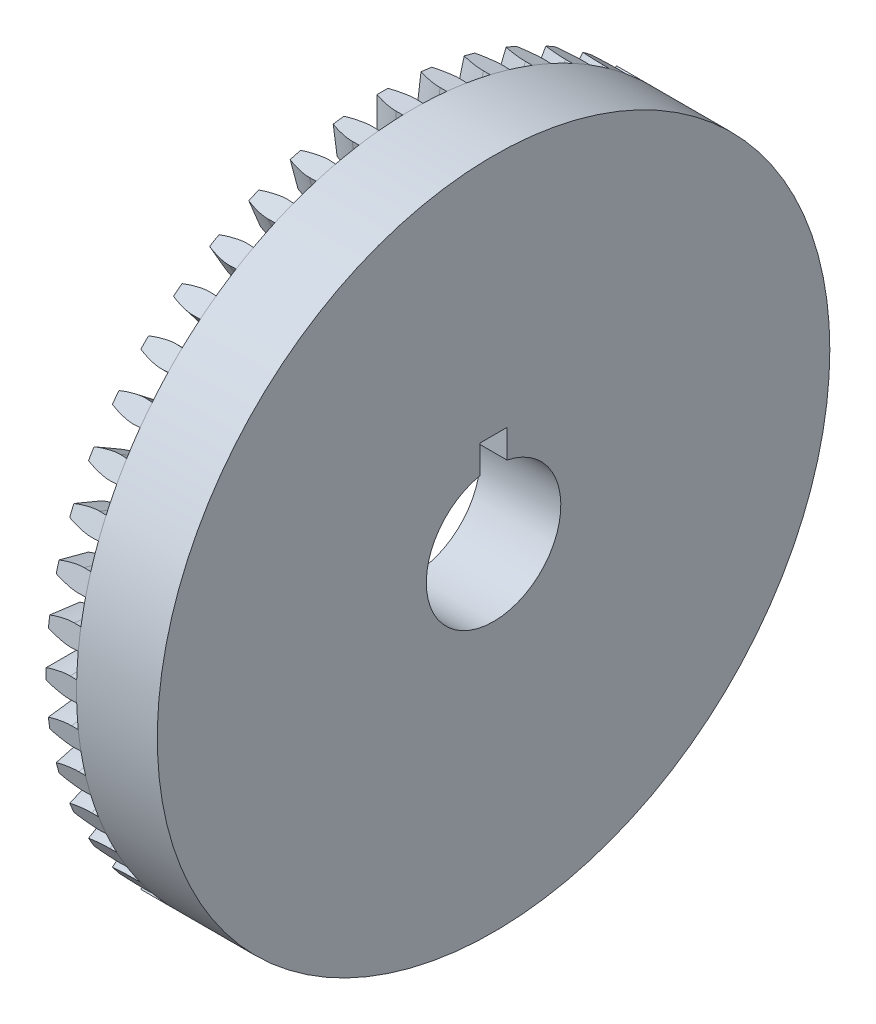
SolidWorks part; units mm, degrees
ref_plane "Front Plane" through (0, 0, 0) normal (0, 0, 1) x (1, 0, 0)
ref_plane "Top Plane" through (0, 0, 0) normal (0, 1, 0) x (1, 0, 0)
ref_plane "Right Plane" through (0, 0, 0) normal (1, 0, 0) x (0, 0, -1)
sketch "Sketch1" plane through (0, 0, 0) normal (0, 1, 0) x (1, 0, 0)
  line L0 (0, 0) -> (0, 11.6178) construction
  line L1 (0, 0) -> (-11.6116, 0.3801) construction
  line L2 (0, 0) -> (-12.5, 0) construction
  line L3 (0, 0) -> (-11.6116, -0.3801) construction
  line L4 (0, 0) -> (-11.5618, -1.1387) construction
  circle A0 centre (0, 0) radius 12 construction
  circle A1 centre (0, 0) radius 11.6178 construction
  circle A2 centre (0, 0) radius 11.375 construction
  circle A3 centre (0, 0) radius 12.5 construction
  spline S0 degree 4 poles (-11.6116, 0.3801) (-11.6327, 0.3808) (-11.6922, 0.3806) (-11.8045, 0.3715) (-11.9863, 0.3445) (-12.2151, 0.2925) (-12.5061, 0.2051) (-12.8412, 0.0768) (-13.1996, -0.0901) (-13.5772, -0.2988) (-13.9415, -0.5304) (-14.2922, -0.782) (-14.6293, -1.0515) (-15.0221, -1.398) (-15.4706, -1.843) (-15.959, -2.3991) (-16.4686, -3.0766) (-16.9366, -3.8026) (-17.3545, -4.5581) (-17.6773, -5.2416) (-17.9239, -5.8395) (-18.1099, -6.3469) (-18.2469, -6.7542) (-18.4041, -7.2738) (-18.5418, -7.7889) (-18.6619, -8.3247) (-18.7825, -8.9457) (-18.8675, -9.5056) (-18.93, -9.9943) (-18.99, -10.6833) (-19.0109, -11.0382) (-19.0337, -11.5915) (-19.0319, -11.8442) (-19.0349, -12.068) (-19.0329, -12.1351) (-19.0327, -12.1836) (-19.0327, -12.2097) knots 0 0 0 0 0 0.005377 0.015084 0.028532 0.04661 0.064855 0.092111 0.119476 0.146842 0.174209 0.201575 0.228941 0.256307 0.307035 0.361767 0.4165 0.471232 0.525964 0.580697 0.608063 0.635429 0.662795 0.690161 0.744894 0.77226 0.799626 0.854358 0.881725 0.909091 0.954545 0.977273 0.988636 0.994318 1 1 1 1 1 construction
  spline S1 degree 4 poles (-11.6116, 0.3801) (-11.6327, 0.3808) (-11.6922, 0.3806) (-11.8045, 0.3715) (-11.9863, 0.3445) (-12.2151, 0.2925) (-12.5061, 0.2051) (-12.8412, 0.0768) (-13.1996, -0.0901) (-13.5772, -0.2988) (-13.9415, -0.5304) (-14.2922, -0.782) (-14.6293, -1.0515) (-15.0221, -1.398) (-15.4706, -1.843) (-15.959, -2.3991) (-16.4686, -3.0766) (-16.9366, -3.8026) (-17.3545, -4.5581) (-17.6773, -5.2416) (-17.9239, -5.8395) (-18.1099, -6.3469) (-18.2469, -6.7542) (-18.4041, -7.2738) (-18.5418, -7.7889) (-18.6619, -8.3247) (-18.7825, -8.9457) (-18.8675, -9.5056) (-18.93, -9.9943) (-18.9724, -10.4811) (-18.9871, -10.6779) (-18.9936, -10.7758) knots 0 0 0 0 0 0.005377 0.015084 0.028532 0.04661 0.064855 0.092111 0.119476 0.146842 0.174209 0.201575 0.228941 0.256307 0.307035 0.361767 0.4165 0.471232 0.525964 0.580697 0.608063 0.635429 0.662795 0.690161 0.744894 0.77226 0.799626 0.854358 0.881725 0.909091 0.909091 0.909091 0.909091 0.909091
  dimension "D1" = 25
  dimension "D2" = 24
  dimension "D3" = 23.2355
  dimension "D4" = 22.75
  dimension "D5" = 11.6178
  dimension "D6" = 1.875
  dimension "D7" = 3.75
  dimension "D8" = 7.5
sketch "Sketch2" plane through (0, 0, 0) normal (0, 1, 0) x (1, 0, 0)
  line L0 (0, 0) -> (-12.5, 0) construction
  line L1 (0, 0) -> (-12.5, 0) construction
  line L2 (0, 0) -> (-11.6116, -0.3801) construction
  line L3 (0, 0) -> (-11.6116, 0.3801) construction
  line L4 (0, 0) -> (-11.5618, -1.1387) construction
  line L5 (0, 0) -> (-11.6116, -0.3801) construction
  line L6 (0, 0) -> (-11.6116, 0.3801) construction
  line L7 (0, 0) -> (-11.5618, -1.1387) construction
  line L8 (-11.6116, -0.3801) -> (-11.3689, -0.3722)
  line L9 (-11.3689, -0.3722) -> (-11.3689, 0.3722)
  line L10 (-11.3202, -1.1149) -> (-11.5618, -1.1387) construction
  line L11 (-11.3689, 0.3722) -> (-11.6116, 0.3801)
  circle A0 centre (0, 0) radius 11.375 construction
  circle A1 centre (0, 0) radius 11.6178 construction
  circle A2 centre (0, 0) radius 12 construction
  circle A3 centre (0, 0) radius 12.5 construction
  circle A4 centre (0, 0) radius 11.375 construction
  circle A5 centre (0, 0) radius 11.6178 construction
  circle A6 centre (0, 0) radius 12 construction
  circle A7 centre (0, 0) radius 12.5 construction
  arc A8 (-12.4984, -0.2024) -> (-12.4984, 0.2024) centre (0, 0) cw
  circle A11 centre (0, 0) radius 2.5 construction
  arc A12 (-2.5, 0) -> (-2.488, -0.245) centre (0, 0) ccw
  spline S0 degree 4 poles (-137.3181, -1995.5374) (-9.3594, -39.3353) (-8.7488, -0.5489) (-10.4188, 0.5771) (-11.9863, 0.3445) (-12.2151, 0.2925) (-12.5061, 0.2051) (-12.8412, 0.0768) (-13.1996, -0.0901) (-13.5772, -0.2988) (-13.9415, -0.5304) (-14.2922, -0.782) (-14.6293, -1.0515) (-15.0221, -1.398) (-15.4706, -1.843) (-15.959, -2.3991) (-16.4686, -3.0766) (-16.9366, -3.8026) (-17.3545, -4.5581) (-17.6773, -5.2416) (-17.9239, -5.8395) (-18.1099, -6.3469) (-18.2469, -6.7542) (-18.4041, -7.2738) (-18.5418, -7.7889) (-18.6619, -8.3247) (-18.7825, -8.9457) (-18.8675, -9.5056) (-19.1455, -11.6787) (-19.1967, -16.4596) (-14.9634, 39.8693) (-149.298, -2006.3739) knots -0.35521 -0.35521 -0.35521 -0.35521 -0.35521 0.005377 0.015084 0.028532 0.04661 0.064855 0.092111 0.119476 0.146842 0.174209 0.201575 0.228941 0.256307 0.307035 0.361767 0.4165 0.471232 0.525964 0.580697 0.608063 0.635429 0.662795 0.690161 0.744894 0.77226 0.799626 0.854358 0.881725 1.380796 1.380796 1.380796 1.380796 1.380796 only from (-11.6116, 0.3801) to (-18.9936, -10.7758) construction
  spline S1 degree 4 poles (-11.6116, 0.3801) (-11.6327, 0.3808) (-11.6922, 0.3806) (-11.8045, 0.3715) (-11.9863, 0.3445) (-12.1873, 0.2988) (-12.3484, 0.2521) (-12.4573, 0.2164) (-12.4984, 0.2024) knots 0 0 0 0 0 0.005377 0.015084 0.028532 0.04661 0.057616 0.057616 0.057616 0.057616 0.057616
  spline S2 degree 4 poles (-11.6116, -0.3801) (-11.6327, -0.3808) (-11.6922, -0.3806) (-11.8045, -0.3715) (-11.9863, -0.3445) (-12.1873, -0.2988) (-12.3484, -0.2521) (-12.4573, -0.2164) (-12.4984, -0.2024) knots 0 0 0 0 0 0.005377 0.015084 0.028532 0.04661 0.057616 0.057616 0.057616 0.057616 0.057616
  point P21 (-11.3689, -0.3722)
  point P24 (-11.3202, -1.1149)
  dimension "D2" = 5
extrude "Boss-Extrude2" add sketch "Sketch2" along normal blind 1.125 contours L8 L9 L11 S1 A8 S2
sketch "Sketch3" plane through (-11.3689, 0, 0) normal (1, 0, 0) x (0, 0, -1)
  circle A0 centre (0, 12.5) radius 12.5
  dimension "D1" = 25
extrude "Boss-Extrude3" add sketch "Sketch3" along normal blind 3
sketch "Sketch4" plane through (-11.3689, 0, 0) normal (-1, 0, 0) x (0, 0, 1)
  circle A0 centre (0, 12.5) radius 2.5
  dimension "D1" = 5
extrude "Cut-Extrude1" cut sketch "Sketch4" against normal up to surface (3 mm away)
pattern_circular "CirPattern1" count 48 over 360 about axis through (-1.2978, 12.5, 0) along (-1, 0, 0) of "Boss-Extrude2"
sketch "Sketch6" plane through (-11.3689, 0, 0) normal (-1, 0, 0) x (0, 0, 1)
  line L1 (-0.5, 14) -> (0.5, 14)
  line L2 (-0.5, 14) -> (-0.5, 16)
  line L3 (-0.5, 16) -> (0.5, 16)
  line L4 (0.5, 14) -> (0.5, 16)
  line L5 (-0.5, 14) -> (0.5, 16) construction
  line L6 (-0.5, 16) -> (0.5, 14) construction
  circle A0 centre (0, 12.5) radius 2.5 construction
  point P0 (0, 15)
  dimension "D1" = 2
  dimension "D2" = 1
extrude "Cut-Extrude2" cut sketch "Sketch6" against normal up to surface (3 mm away)
equation "\"Module\"= .5"
equation "\"Number of Teeth\"= 48"
equation "\"Pressure Angle\"= 14.5deg"
equation "\"Pitch Diameter\"= \"Number of Teeth\" * \"Module\""
equation "\"Circular Pitch\"= pi * \"Module\""
equation "\"Addendum\"= \"Module\""
equation "\"Dedendum\"= 1.25 * \"Module\""
equation "\"Base Diameter\"= \"Pitch Diameter\" * cos ( \"Pressure Angle\" )"
equation "\"Base Radius\"= \"Base Diameter\" / 2"
equation "\"Width\"= 3"
equation "\"Outside Diameter\"= \"Pitch Diameter\" + 2 * \"Addendum\""
equation "\"D1@Sketch1\"=\"Outside Diameter\""
equation "\"D3@Sketch1\"=\"Base Diameter\""
equation "\"Root Diameter\"= \"Pitch Diameter\" - 2 * \"Dedendum\""
equation "\"D4@Sketch1\"=\"Root Diameter\""
equation "\"Tooth Angle\"= 360 / \"Number of Teeth\""
equation "\"D6@Sketch1\"=\"Tooth Angle\"/4"
equation "\"D7@Sketch1\"=\"Tooth Angle\"/2"
equation "\"D8@Sketch1\"=\"Tooth Angle\""
equation "\"D2@Sketch1\" = \"Pitch Diameter\""
equation "\"Shaft Diameter\" = 5"
equation "\"D2@Sketch2\"= \"Shaft Diameter\""
equation "\"D1@Boss-Extrude3\"=\"Width\""
equation "\"D1@Boss-Extrude2\"=(\"Addendum\"+\"Dedendum\")"
equation "\"D1@Sketch3\"=\"Outside Diameter\""
equation "\"D1@Sketch4\"=\"Shaft Diameter\""
equation "\"D1@CirPattern1\"=\"Number of Teeth\""
